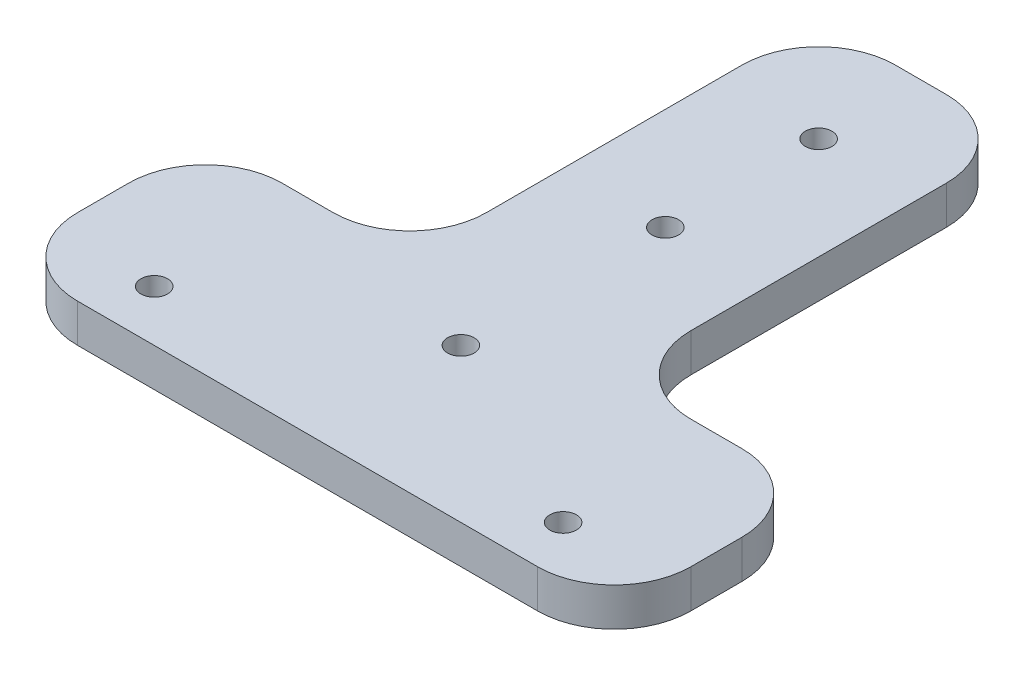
SolidWorks part; units mm, degrees
ref_plane "Front Plane" through (0, 0, 0) normal (0, 0, 1) x (1, 0, 0)
ref_plane "Top Plane" through (0, 0, 0) normal (0, 1, 0) x (1, 0, 0)
ref_plane "Right Plane" through (0, 0, 0) normal (1, 0, 0) x (0, 0, -1)
sketch "Sketch1" plane through (0, 0, 0) normal (0, 1, 0) x (1, 0, 0)
  line L0 (0, 0) -> (76.2, 0)
  line L1 (0, 0) -> (-76.2, 0)
  line L2 (-76.2, 0) -> (-76.2, 50.8)
  line L3 (-76.2, 50.8) -> (-25.4, 50.8)
  line L4 (-25.4, 50.8) -> (-25.4, 152.4)
  line L5 (-25.4, 152.4) -> (25.4, 152.4)
  line L6 (25.4, 152.4) -> (25.4, 50.8)
  line L7 (25.4, 50.8) -> (76.2, 50.8)
  line L8 (76.2, 50.8) -> (76.2, 0)
  dimension "D1" = 76.2
  dimension "D2" = 152.4
  dimension "D3" = 152.4
  dimension "D4" = 50.8
  dimension "D5" = 50.8
  dimension "D6" = 25.4
  dimension "D7" = 25.4
extrude "Boss-Extrude1" add sketch "Sketch1" along normal blind 9.525
sketch "Sketch2" plane through (0, 9.525, 0) normal (0, 1, 0) x (1, 0, 0)
  line L0 (76.2, 0) -> (76.2, 50.8) construction
  line L1 (-76.2, 0) -> (76.2, 0) construction
  line L2 (-76.2, 0) -> (76.2, 0) construction
  circle A0 centre (0, 127) radius 3.302
  circle A1 centre (0, 88.9) radius 3.302
  circle A2 centre (-50.8, 12.7) radius 3.302
  circle A3 centre (0, 38.1) radius 3.302
  circle A4 centre (50.8, 12.7) radius 3.302
  dimension "D1" = 6.604
  dimension "D2" = 38.1
  dimension "D3" = 38.1
  dimension "D4" = 76.2
  dimension "D6" = 12.7
  dimension "D7" = 12.7
  dimension "D8" = 50.8
  dimension "D9" = 50.8
  dimension "D10" = 127
extrude "holes" cut sketch "Sketch2" against normal through all
fillet "Fillet1" radius 19.05 8 edges at (76.2, 4.7625, 0) (76.2, 4.7625, -50.8) (25.4, 4.7625, -50.8) (-76.2, 4.7625, 0) (-76.2, 4.7625, -50.8) (-25.4, 4.7625, -50.8) (25.4, 4.7625, -152.4) (-25.4, 4.7625, -152.4)
